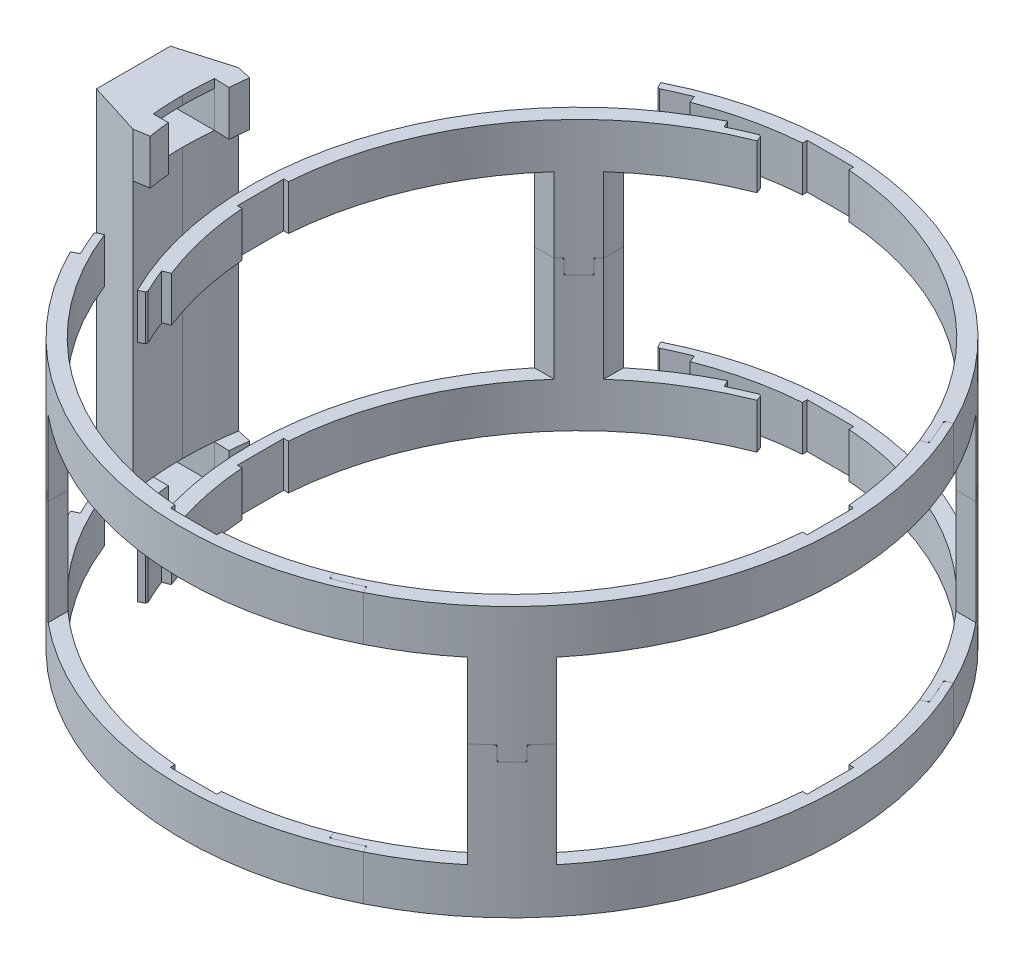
SolidWorks part; units mm, degrees
ref_plane "Front Plane" through (0, 0, 0) normal (0, 0, 1) x (1, 0, 0)
ref_plane "Top Plane" through (0, 0, 0) normal (0, 1, 0) x (1, 0, 0)
ref_plane "Right Plane" through (0, 0, 0) normal (1, 0, 0) x (0, 0, -1)
sketch "Sketch1" plane through (0, 0, 0) normal (0, 1, 0) x (1, 0, 0)
  circle A0 centre (0, 0) radius 105
  circle A1 centre (0, 0) radius 110
  dimension "D1" = 210
  dimension "D2" = 220
sketch "Sketch2" plane through (0, 0, 0) normal (0, 0, 1) x (1, 0, 0)
  line L0 (0, 0) -> (0, 45)
  line L1 (0, 0) -> (0, -45)
  dimension "D1" = 45
sweep "Sweep1" add profiles "Sketch1" path "Sketch2"
sketch "Sketch4" plane through (0, 0, 0) normal (0, 0, 1) x (1, 0, 0)
  line L1 (70, -30) -> (-70, -30)
  line L2 (70, -30) -> (70, 30)
  line L3 (70, 30) -> (-70, 30)
  line L4 (-70, -30) -> (-70, 30)
  line L5 (70, -30) -> (-70, 30) construction
  line L6 (70, 30) -> (-70, -30) construction
  line L12 (-110, -45) -> (110, -45) construction
  line L13 (110, 45) -> (-110, 45) construction
  point P0 (0, 0)
  dimension "D1" = 15
  dimension "D2" = 15
  dimension "D3" = 140
extrude "Cut-Extrude2" cut sketch "Sketch4" against normal through all
pattern_circular "CirPattern2" count 4 every 90 about axis through (0, 0, 0) along (0, 1, 0) of "Cut-Extrude2"
sketch "Sketch5" plane through (0, 0, 0) normal (0, 1, 0) x (1, 0, 0)
  circle A0 centre (74.3525, -74.1397) radius 1.1
  circle A1 centre (0, 0) radius 105 construction
  dimension "D1" = 2.2
sketch "Sketch6" plane through (0, 0, 0) normal (0, 0, 1) x (1, 0, 0)
  line L0 (0, 0) -> (0, 40)
  line L1 (0, 0) -> (0, -40)
  dimension "D1" = 40
sketch "Sketch7" plane through (0, 0, 0) normal (1, 0, 0) x (0, 0, -1)
  line L0 (-105, 45) -> (-105, 30) construction
  line L1 (110, 45) -> (-110, 45) construction
  circle A0 centre (-105, 40) radius 1.1
  dimension "D1" = 5
  dimension "D2" = 2.2
sketch "Sketch10" plane through (0, 45, 0) normal (0, 1, 0) x (1, 0, 0)
  line L1 (-7.75, 103.7) -> (7.75, 103.7)
  line L2 (-7.75, 103.7) -> (-7.75, 106.3)
  line L3 (-7.75, 106.3) -> (7.75, 106.3)
  line L4 (7.75, 103.7) -> (7.75, 106.3)
  line L5 (-7.75, 103.7) -> (7.75, 106.3) construction
  line L6 (-7.75, 106.3) -> (7.75, 103.7) construction
  circle A0 centre (0, 0) radius 105 construction
  point P8 (0, 105)
  dimension "D1" = 15.5
  dimension "D2" = 2.6
extrude "Cut-Extrude3" cut sketch "Sketch10" against normal blind 17
pattern_circular "CirPattern4" count 4 every 90 about axis through (0, 0, 0) along (0, 1, 0) of "Cut-Extrude3"
mirror "Mirror2" about plane through (0, 0, 0) normal (0, 1, 0) of "CirPattern4", "Cut-Extrude3"
sketch "Sketch11" plane through (0, 0, 0) normal (0, 1, 0) x (1, 0, 0)
  line L1 (0, 0) -> (-39.2149, 100.0922)
  line L2 (0, 0) -> (39.2149, -100.0922)
  line L4 (-47.7893, 96.2935) -> (-86.3128, 173.9166)
  line L5 (47.7893, -96.2935) -> (69.6852, -140.4129)
  arc A0 (-39.2149, 100.0922) -> (-47.7893, 96.2935) centre (0, 0) ccw
  arc A2 (39.2149, -100.0922) -> (47.7893, -96.2935) centre (0, 0) ccw
  dimension "D1" = 107.5
surface "Surface-Extrude1" sketch "Sketch11" parameters "D1"=56, "D2"=78
sketch "Sketch12" plane through (0, 0, 0) normal (0, 1, 0) x (1, 0, 0)
  line L0 (0, 0) -> (-100.0922, -39.2149)
  line L1 (0, 0) -> (100.0922, 39.2149)
  line L2 (-96.2935, -47.7893) -> (-130.8305, -64.9296)
  line L3 (96.2935, 47.7893) -> (137.7632, 68.3702)
  arc A0 (-100.0922, -39.2149) -> (-96.2935, -47.7893) centre (0, 0) ccw
  arc A1 (100.0922, 39.2149) -> (96.2935, 47.7893) centre (0, 0) ccw
  dimension "D1" = 107.5
surface "Surface-Extrude2" sketch "Sketch12"
split "Split1" trimming surface bodies 114 115 bodies to split 112 resulting bodies 116 117 118 119
sketch "Sketch14" plane through (0, 0, 0) normal (0, 0, 1) x (1, 0, 0)
  line L0 (5, 0) -> (-5, 0)
  line L1 (5, 0) -> (5, 5)
  line L2 (5, 5) -> (22, 5)
  line L3 (-5, 0) -> (-5, 5)
  line L4 (-5, 5) -> (-23.1461, 5)
  dimension "D1" = 10
  dimension "D2" = 5
sketch "Sketch16" plane through (0, 0, 0) normal (0, 1, 0) x (1, 0, 0)
  line L0 (0, 0) -> (-105.5886, -106.5413)
  line L1 (0, 0) -> (105.5886, 106.5413)
  dimension "D1" = 150
surface "Surface-Sweep1"
sketch "Sketch17" plane through (0, 0, 0) normal (0, 0, 1) x (1, 0, 0)
  line L0 (5, 0) -> (-5, 0)
  line L1 (5, 0) -> (5, 5)
  line L2 (5, 5) -> (22, 5)
  line L3 (-5, 0) -> (-5, 5)
  line L4 (-5, 5) -> (-22.6353, 5)
  dimension "D1" = 10
  dimension "D2" = 5
sketch "Sketch18" plane through (0, 0, 0) normal (0, 1, 0) x (1, 0, 0)
  line L0 (0, 0) -> (102.5549, -102.5549)
  line L1 (0, 0) -> (-100.1027, 100.1027)
surface "Surface-Sweep2"
split "Split2" trimming surface bodies 121 120 bodies to split 118 117 119 116 resulting bodies 122 123 124 125 126 127 128 129
chamfer "Chamfer1" distance 0.5 angle 45 2 edges at (-73.1081, 0, 78.8128) (-78.153, 0, 73.813)
chamfer "Chamfer2" distance 0.5 angle 45 2 edges at (73.4728, 0, 78.4728) (78.4728, 0, 73.4728)
chamfer "Chamfer3" distance 0.5 angle 45 2 edges at (78.153, 0, -73.813) (73.1081, 0, -78.8128)
chamfer "Chamfer4" distance 0.5 angle 45 2 edges at (-78.4728, 0, -73.4728) (-73.4728, 0, -78.4728)
chamfer "Chamfer5" distance 0.5 angle 45 2 edges at (78.4728, 5, 73.4728) (73.4728, 5, 78.4728)
chamfer "Chamfer6" distance 0.5 angle 45 2 edges at (73.1081, 5, -78.8128) (78.153, 5, -73.813)
chamfer "Chamfer7" distance 0.5 angle 45 2 edges at (-73.4728, 5, -78.4728) (-78.4728, 5, -73.4728)
chamfer "Chamfer8" distance 0.5 angle 45 2 edges at (-78.153, 5, 73.813) (-73.1081, 5, 78.8128)
chamfer "Chamfer11" distance 0.5 angle 45 1 edges at (100.0922, -37.5, -39.2149)
chamfer "Chamfer12" distance 0.5 angle 45 1 edges at (96.2935, -37.5, -47.7893)
chamfer "Chamfer15" distance 0.5 angle 45 1 edges at (-100.0922, -37.5, 39.2149)
chamfer "Chamfer16" distance 0.5 angle 45 1 edges at (-96.2935, -37.5, 47.7893)
chamfer "Chamfer17" distance 0.5 angle 45 1 edges at (96.2935, 37.5, -47.7893)
chamfer "Chamfer18" distance 0.5 angle 45 1 edges at (100.0922, 37.5, -39.2149)
chamfer "Chamfer21" distance 0.5 angle 45 1 edges at (-96.2935, 37.5, 47.7893)
chamfer "Chamfer22" distance 0.5 angle 45 1 edges at (-100.0922, 37.5, 39.2149)
chamfer "Chamfer23" distance 0.5 angle 45 1 edges at (-47.7893, -37.5, -96.2935)
chamfer "Chamfer24" distance 0.5 angle 45 1 edges at (-39.2149, -37.5, -100.0922)
chamfer "Chamfer25" distance 0.5 angle 45 1 edges at (47.7893, -37.5, 96.2935)
chamfer "Chamfer26" distance 0.5 angle 45 1 edges at (39.2149, -37.5, 100.0922)
chamfer "Chamfer27" distance 0.5 angle 45 1 edges at (-39.2149, 37.5, -100.0922)
chamfer "Chamfer28" distance 0.5 angle 45 1 edges at (-47.7893, 37.5, -96.2935)
chamfer "Chamfer29" distance 0.5 angle 45 1 edges at (39.2149, 37.5, 100.0922)
chamfer "Chamfer30" distance 0.5 angle 45 1 edges at (47.7893, 37.5, 96.2935)
split "Split3" trim tools "Surface-Sweep2", "Surface-Sweep1" bodies to split 128 129 127 122 124 125 126 123 resulting bodies 155 156 157 158 159 160 161 162
sketch "Sketch20" plane through (0, 0, 0) normal (0, 1, 0) x (1, 0, 0)
  line L1 (-67, 92.5) -> (67, 92.5)
  line L2 (-67, 92.5) -> (-67, -92.5)
  line L3 (-67, -92.5) -> (67, -92.5)
  line L4 (67, 92.5) -> (67, -92.5)
  line L5 (-67, 92.5) -> (67, -92.5) construction
  line L6 (-67, -92.5) -> (67, 92.5) construction
  point P0 (0, 0)
  dimension "D1" = 185
  dimension "D2" = 134
sketch "Sketch23" plane through (0, 0, 0) normal (0, 1, 0) x (1, 0, 0)
  line L0 (-108.6172, 17.387) -> (-126.2616, 12.2275)
  line L1 (-126.2616, -12.435) -> (-108.516, -18.0076)
  line L2 (-126.2616, -12.435) -> (-126.2616, 12.2275)
  arc A0 (-110, 0) -> (-108.6172, 17.387) centre (0, 0) cw
  arc A1 (-48.9007, 98.5329) -> (-98.5329, -48.9007) centre (0, 0) ccw construction
  arc A2 (-110, 0) -> (-108.516, -18.0076) centre (0, 0) ccw
  point P10 (0, 0)
  point P11 (-108.6172, -18.0244)
  point P13 (-119.4699, -9.8904)
  point P14 (-119.313, 9.8781)
  point P15 (-119.3685, -11.4411)
  point P16 (-119.4393, 10.2751)
  point P17 (-119.507, -12.3098)
  point P18 (-119.3755, 11.2869)
  point P19 (-122.8946, -12.6551)
  point P20 (-123.1105, 10.8214)
  point P21 (-126.5969, 10.4661)
  point P22 (0, 0)
  point P23 (0, 0)
  point P24 (-126.386, -12.3959)
  point P25 (-126.3552, 11.6657)
  point P26 (-126.2616, 12.2275)
sketch "Sketch26" plane through (0, 0, 0) normal (1, 0, 0) x (0, 0, -1)
  line L0 (0, 0) -> (0, 60)
  line L1 (0, 0) -> (0, -60)
  dimension "D1" = 60
sketch "Sketch28" plane through (-106.3, 0, 0) normal (1, 0, 0) x (0, 0, -1)
  line L0 (-10.2104, 57.145) -> (-10.2104, 45)
  line L1 (-10.2104, 57.145) -> (10.2326, 57.145)
  line L2 (-10.2104, 45) -> (10.2326, 45)
  line L3 (10.2326, 57.145) -> (10.2326, 45)
  point P0 (-10.2104, 57.145)
  point P1 (0, 50.3533)
sweep "Sweep8" add profiles "Sketch23" path "Sketch26"
extrude "Cut-Extrude6" cut sketch "Sketch28" against normal blind 17
mirror "Mirror4" about plane through (0, 0, 0) normal (0, 1, 0) of "Cut-Extrude6"
sketch "Sketch31" plane through (0, 45, 0) normal (0, 1, 0) x (1, 0, 0)
  line L0 (-109.5251, -10.2104) -> (-104.5024, -10.2104)
  line L1 (-108.5162, -18.0066) -> (-103.5829, -17.1923)
  arc A0 (-108.5162, -18.0066) -> (-109.5251, -10.2104) centre (0, 0) cw
  arc A1 (-48.9007, 98.5329) -> (-98.5329, -48.9007) centre (0, 0) ccw construction
  arc A2 (-110, 0) -> (-109.5251, -10.2104) centre (0, 0) ccw construction
  arc A3 (-104.5024, -10.2104) -> (-103.5829, -17.1923) centre (0, 0) ccw
  arc A4 (-104.7136, -7.75) -> (-97.7644, -38.3029) centre (0, 0) ccw construction
move or copy body "Body-Move/Copy3" bodies to move or copy 161 162 copy no translate (22.7558, 0, 0) parameters "D1"=22.7558, "D2"=0, "D3"=0
extrude "Boss-Extrude2" add sketch "Sketch31" along normal blind 15
mirror "Mirror7" about plane through (0, 0, 0) normal (0, 1, 0) of "Boss-Extrude2"
move or copy body "Body-Move/Copy4" bodies to move or copy 180 181 copy no translate (-0.402, 0, 0) parameters "D1"=0.402, "D2"=0, "D3"=0
sketch "Sketch32" plane through (0, 45, 0) normal (0, 1, 0) x (1, 0, 0)
  line L0 (-104.5299, 10.0485) -> (-109.523, 10.2326)
  line L1 (-103.8781, 16.3081) -> (-108.7713, 17.39)
  arc A0 (-109.523, 10.2326) -> (-108.7713, 17.39) centre (22.3538, 0) cw
  arc A1 (-104.5299, 10.0485) -> (-103.8781, 16.3081) centre (22.3538, 0) cw
extrude "Boss-Extrude3" add sketch "Sketch32" along normal blind 15
mirror "Mirror11" about plane through (0, 0, 0) normal (0, 1, 0) of "Boss-Extrude3"
split "Split4" bodies to split 189 resulting bodies 190
